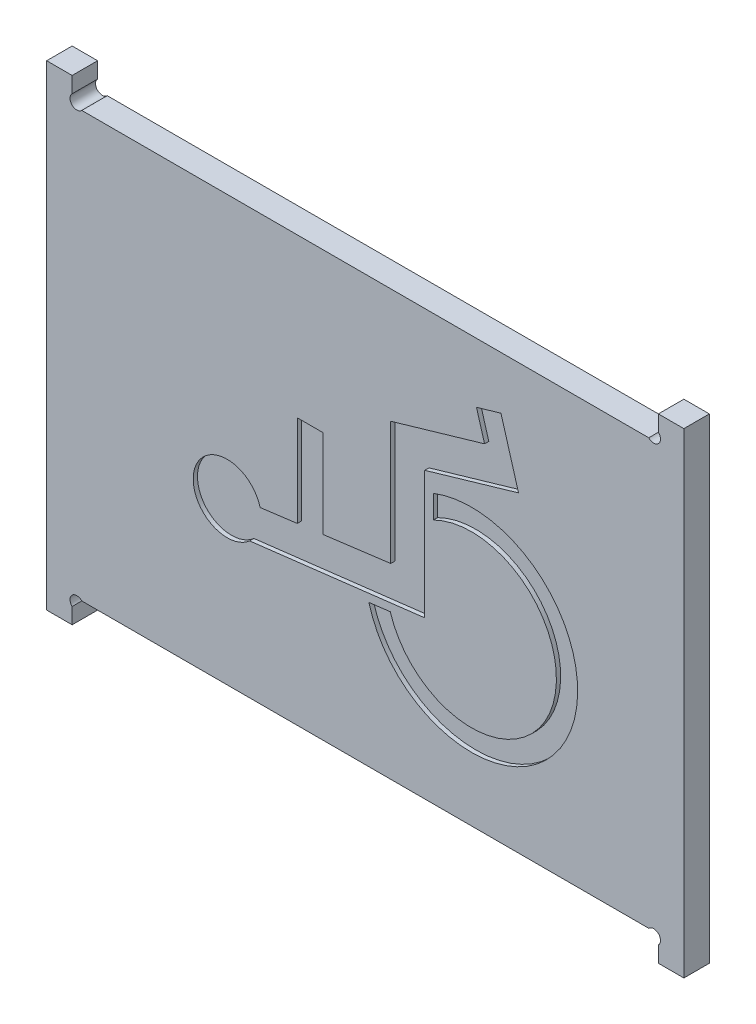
SolidWorks part; units mm, degrees
ref_plane "Face" through (0, 0, 0) normal (0, 0, 1) x (1, 0, 0)
ref_plane "Dessus" through (0, 0, 0) normal (0, 1, 0) x (1, 0, 0)
ref_plane "Droite" through (0, 0, 0) normal (1, 0, 0) x (0, 0, -1)
sketch "Esquisse1" plane through (0, 0, 0) normal (0, 0, 1) x (1, 0, 0)
  line L0 (99.7591, 29.4031) -> (99.7591, 35.4031)
  line L1 (-38.2409, 29.4031) -> (99.7591, 29.4031)
  line L2 (-44.2409, 29.4031) -> (-44.2409, -70.5969)
  line L3 (-38.2409, -70.5969) -> (99.7591, -70.5969)
  line L4 (105.7591, -40.4047) -> (105.7591, -70.5969)
  line L5 (99.7591, 35.4031) -> (105.7591, 35.4031)
  line L6 (105.7591, 35.4031) -> (105.7591, -40.4047)
  line L7 (105.7591, -70.5969) -> (105.7591, -76.5969)
  line L8 (105.7591, -76.5969) -> (99.7591, -76.5969)
  line L9 (99.7591, -76.5969) -> (99.7591, -70.5969)
  line L10 (-44.2409, 29.4031) -> (-44.2409, 35.4031)
  line L11 (-44.2409, 35.4031) -> (-38.2409, 35.4031)
  line L12 (-38.2409, 35.4031) -> (-38.2409, 29.4031)
  line L13 (-44.2409, -70.5969) -> (-44.2409, -76.5969)
  line L14 (-44.2409, -76.5969) -> (-38.2409, -76.5969)
  line L15 (-38.2409, -76.5969) -> (-38.2409, -70.5969)
  dimension "D2" = 100
  dimension "D3" = 6
  dimension "D4" = 6
  dimension "D5" = 6
  dimension "D6" = 6
  dimension "D7" = 6
  dimension "D8" = 6
  dimension "D9" = 6
  dimension "D10" = 6
  dimension "D11" = 150
extrude "Base-Extrusion" add sketch "Esquisse1" along normal blind 6
sketch "Esquisse2" plane through (0, 0, 6) normal (0, 0, 1) x (1, 0, 0)
  line L0 (99.7591, 29.4031) -> (-38.2409, 29.4031) construction
  line L1 (3.5506, -38.5969) -> (44.7591, -33.671)
  line L2 (105.7591, -76.5969) -> (105.7591, 35.4031) construction
  line L4 (44.7591, -11.232) -> (44.7591, -3.5969)
  line L5 (44.7591, -3.5969) -> (66.8391, 2.8431)
  line L6 (66.8391, 2.8431) -> (62.7045, 17.0189)
  line L7 (62.7045, 17.0189) -> (56.9445, 15.3389)
  line L8 (56.9445, 15.3389) -> (58.8391, 8.8431)
  line L9 (58.8391, 8.8431) -> (36.7591, 2.4031)
  line L10 (5.995, -30.5585) -> (14.7591, -29.4299)
  line L11 (36.7591, -26.5969) -> (36.7591, -4.6072)
  line L12 (44.7591, -11.232) -> (44.7591, -33.671)
  line L13 (20.7591, -28.6572) -> (36.7591, -26.5969)
  line L14 (36.7591, 2.4031) -> (36.7591, -4.6072)
  line L15 (14.7591, -29.4299) -> (14.7591, -7.8892)
  line L16 (14.7591, -7.8892) -> (20.7591, -7.8892)
  line L17 (20.7591, -28.6572) -> (20.7591, -7.8892)
  line L18 (31.6203, -37.1021) -> (36.6436, -36.4788)
  line L19 (46.7733, -12.7292) -> (46.7733, -7.2676)
  arc A0 (31.6203, -37.1021) -> (46.7733, -7.2676) centre (55.7591, -30.5969) ccw
  arc A1 (36.6436, -36.4788) -> (46.7733, -12.7292) centre (55.7591, -30.5969) ccw
  arc A2 (5.995, -30.5585) -> (3.5506, -38.5969) centre (-1.7409, -32.5969) ccw
  dimension "D3" = 50
  dimension "D4" = 40
  dimension "D10" = 16
  dimension "D1" = 60
  dimension "D2" = 50
  dimension "D7" = 8
  dimension "D9" = 11
  dimension "D12" = 57.5
  dimension "D14" = 6
  dimension "D16" = 16
  dimension "D17" = 23
  dimension "D18" = 6
  dimension "D19" = 23
  dimension "D20" = 8
extrude "Enlèv. mat.-Extru.1" cut sketch "Esquisse2" against normal blind 1
sketch "Esquisse3" plane through (0, 0, 6) normal (0, 0, 1) x (1, 0, 0)
  line L0 (-38.2409, -70.5969) -> (99.7591, -70.5969) construction
  line L1 (-38.2409, -76.5969) -> (-38.2409, -70.5969) construction
  line L2 (99.7591, -70.5969) -> (99.7591, -76.5969) construction
  line L3 (99.7591, 35.4031) -> (99.7591, 29.4031) construction
  line L4 (99.7591, 29.4031) -> (-38.2409, 29.4031) construction
  line L5 (-38.2409, 29.4031) -> (-38.2409, 35.4031) construction
  circle A0 centre (-37.1409, -71.6969) radius 1.6
  circle A1 centre (98.6591, -71.6969) radius 1.6
  circle A2 centre (98.6591, 30.5031) radius 1.6
  circle A3 centre (-37.1409, 30.5031) radius 1.6
  point P8 (99.7591, -73.5969)
  point P13 (99.7591, 32.4031)
  dimension "D1" = 1.1
  dimension "D3" = 1.1
  dimension "D5" = 1.1
  dimension "D7" = 1.1
  dimension "D2" = 1.1
  dimension "D4" = 1.1
  dimension "D6" = 1.1
  dimension "D8" = 1.1
extrude "Enlèv. mat.-Extru.2" cut sketch "Esquisse3" against normal up to vertex
